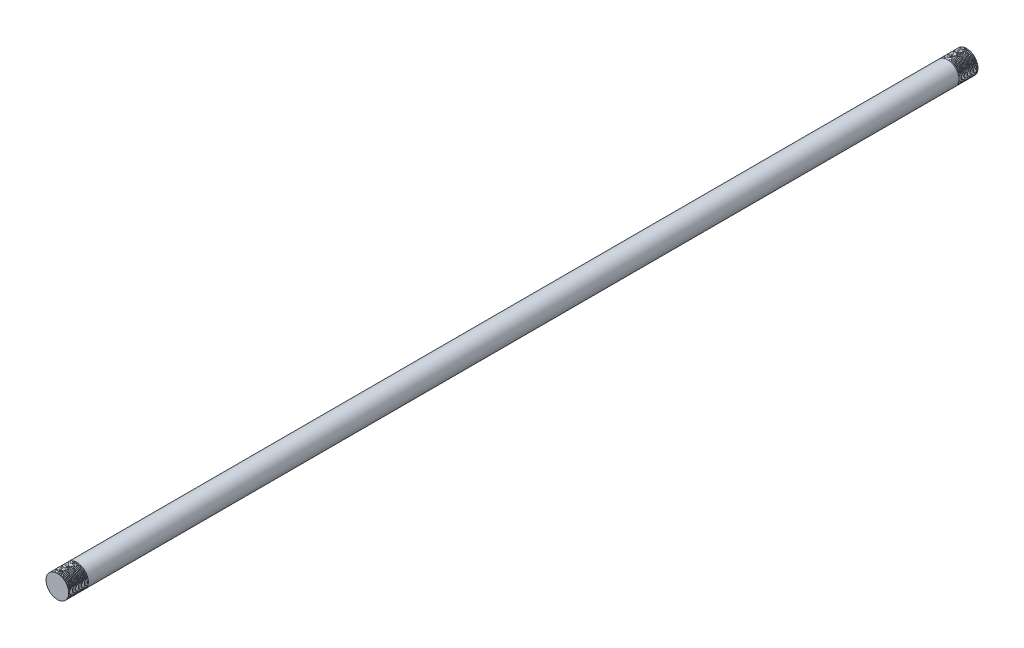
SolidWorks part; units mm, degrees
ref_plane "Front Plane" through (0, 0, 0) normal (0, 0, 1) x (1, 0, 0)
ref_plane "Top Plane" through (0, 0, 0) normal (0, 1, 0) x (1, 0, 0)
ref_plane "Right Plane" through (0, 0, 0) normal (1, 0, 0) x (0, 0, -1)
sketch "Sketch1" plane through (0, 0, 0) normal (0, 0, 1) x (1, 0, 0)
  circle A0 centre (0, 0) radius 3
  dimension "D1" = 6
extrude "Boss-Extrude1" add sketch "Sketch1" along normal mid plane 240.42
thread "Thread1" pitch 0.3175 start angle 0, offset 0, length 5, pitch 0.3175, diameter 6
ref_plane "Plane1" through (-3, 0, 120.21) normal (0, -1, 0) x (-1, 0, 0)
sketch "Thread Profile1" plane through (-3, 0, 120.21) normal (0, -1, 0) x (-1, 0, 0)
  line L0 (0, 0) -> (0, 0.3175) construction
  line L11 (0, 0) -> (0, 0.2778)
  line L12 (0, 0.2778) -> (-0.1719, 0.1786)
  line L13 (-0.1719, 0.1786) -> (-0.1719, 0.0992)
  line L15 (-0.1719, 0.0992) -> (0, 0)
  line L17 (-0.1719, 0.1389) -> (0, 0.1389) construction
  point P2 (0, 0)
  dimension "Pitch" = 0.3175
  dimension "Profile_Angle" = 60
  dimension "Profile_Land" = 0.0794
  dimension "Profile_Height" = 0.1719
thread "Thread2" pitch 0.3175 start angle 0, offset 0, length 5, pitch 0.3175, diameter 6
ref_plane "Plane2" through (3, 0, -120.21) normal (0, -1, 0) x (1, 0, 0)
sketch "Thread Profile2" plane through (3, 0, -120.21) normal (0, -1, 0) x (1, 0, 0)
  line L0 (0, 0) -> (0, 0.3175) construction
  line L11 (0, 0) -> (0, 0.2778)
  line L12 (0, 0.2778) -> (-0.1719, 0.1786)
  line L13 (-0.1719, 0.1786) -> (-0.1719, 0.0992)
  line L15 (-0.1719, 0.0992) -> (0, 0)
  line L17 (-0.1719, 0.1389) -> (0, 0.1389) construction
  point P2 (0, 0)
  dimension "Pitch" = 0.3175
  dimension "Profile_Angle" = 60
  dimension "Profile_Land" = 0.0794
  dimension "Profile_Height" = 0.1719
